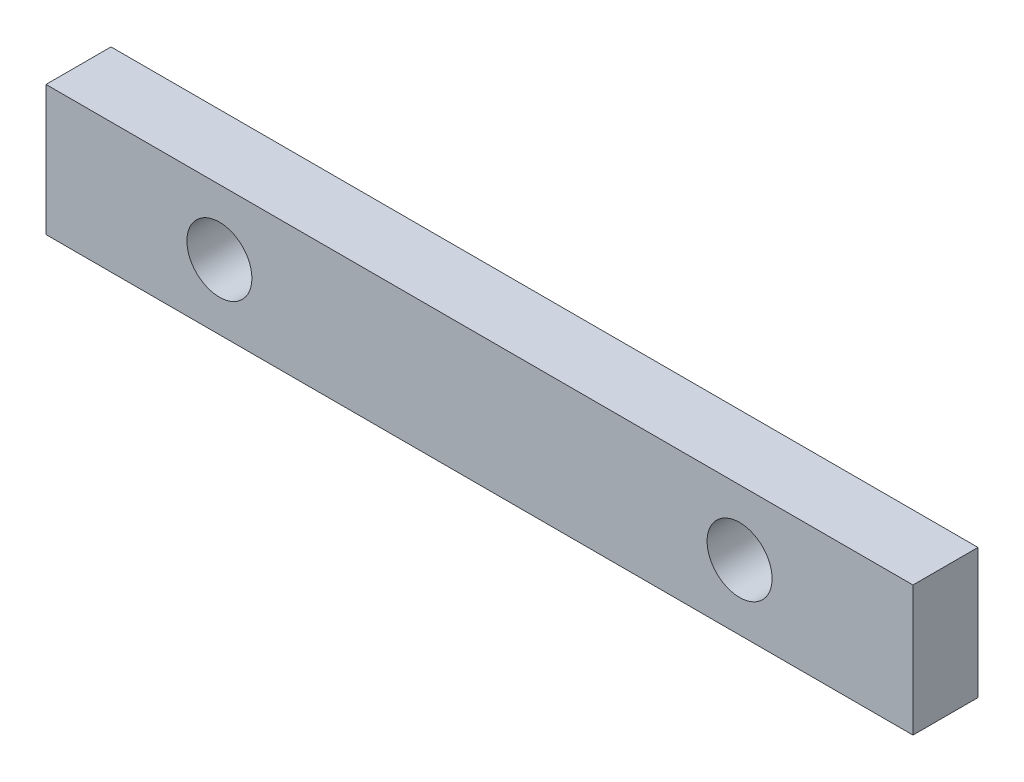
SolidWorks part; units mm, degrees
ref_plane "Face" through (0, 0, 0) normal (0, 0, 1) x (1, 0, 0)
ref_plane "Dessus" through (0, 0, 0) normal (0, 1, 0) x (1, 0, 0)
ref_plane "Droite" through (0, 0, 0) normal (1, 0, 0) x (0, 0, -1)
sketch "Esquisse1" plane through (0, 0, 0) normal (0, 0, 1) x (1, 0, 0)
  line L1 (0, 0) -> (40, 0)
  line L2 (0, 0) -> (0, 6)
  line L3 (0, 6) -> (40, 6)
  line L4 (40, 0) -> (40, 6)
  dimension "D1" = 6
  dimension "D2" = 40
extrude "Extrusion1" add sketch "Esquisse1" along normal blind 3
sketch "Esquisse2" plane through (0, 0, 3) normal (0, 0, 1) x (1, 0, 0)
  line L0 (0, 6) -> (0, 0) construction
  line L1 (40, 6) -> (0, 6) construction
  line L2 (40, 0) -> (40, 6) construction
  circle A0 centre (8, 3) radius 1.5
  circle A1 centre (32, 3) radius 1.5
  dimension "D1" = 3
  dimension "D4" = 3
  dimension "D2" = 8
  dimension "D3" = 3
  dimension "D5" = 8
extrude "Enlèv. mat.-Extru.1" cut sketch "Esquisse2" against normal through all
